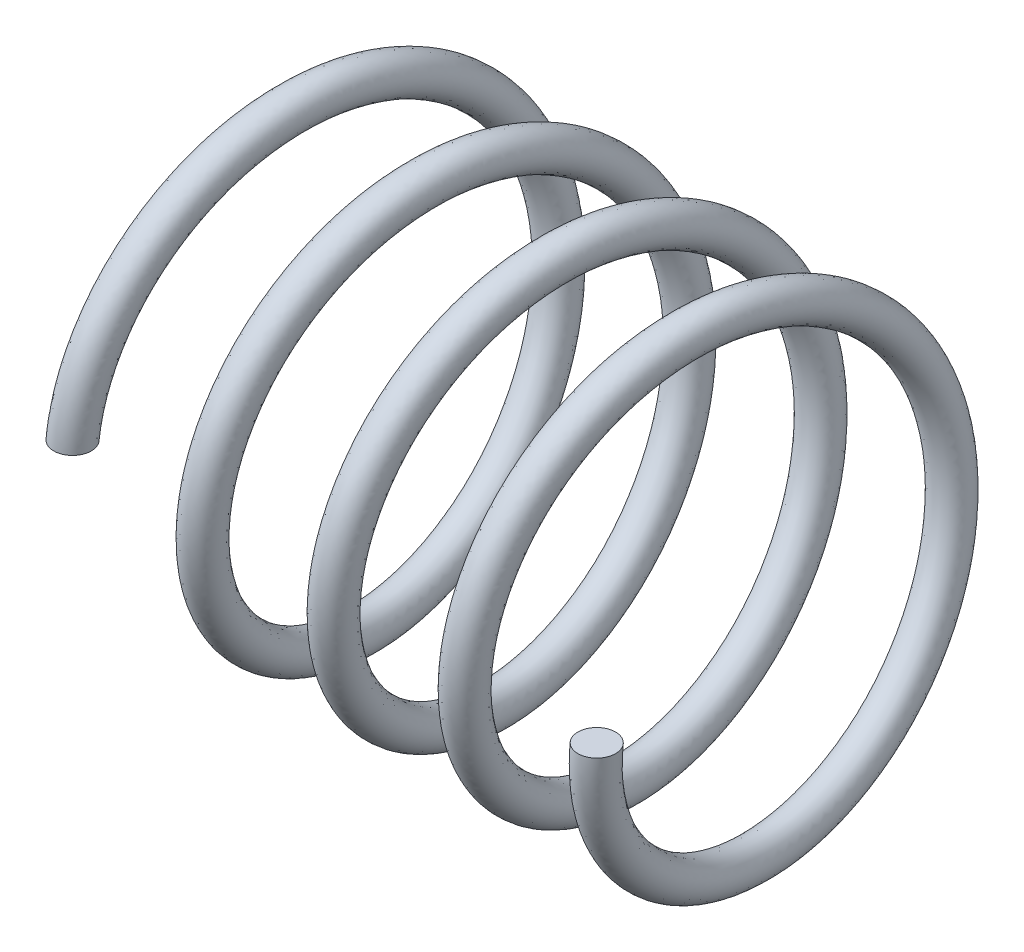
SolidWorks part; units mm, degrees
ref_plane "Front Plane" through (0, 0, 0) normal (0, 0, 1) x (1, 0, 0)
ref_plane "Top Plane" through (0, 0, 0) normal (0, 1, 0) x (1, 0, 0)
ref_plane "Right Plane" through (0, 0, 0) normal (1, 0, 0) x (0, 0, -1)
sketch "Sketch1" plane through (0, 0, 0) normal (1, 0, 0) x (0, 0, -1)
  circle A0 centre (0, 0) radius 6.096
  dimension "D1" = 12.192
curve "Helix/Spiral1"
sketch "Sketch2" plane through (0, 0, 0) normal (0, 1, 0) x (1, 0, 0)
  line L0 (0, -6.096) -> (0, 6.096) construction
  circle A0 centre (0, -6.096) radius 0.5461
  spline S0 degree 3 number of poles 67 (0, -6.096) -> (15.24, -6.096) construction
  dimension "D1" = 1.0922
sweep "Sweep1" add profiles "Sketch2" path "Helix/Spiral1"
ref_plane "Plane1" through (19.05, 0, 0) normal (1, 0, 0) x (0, 0, -1)
sketch "Sketch4" plane through (19.05, 0, 0) normal (1, 0, 0) x (0, 0, -1)
  circle A0 centre (0, 0) radius 3.175
  dimension "D1" = 6.35
